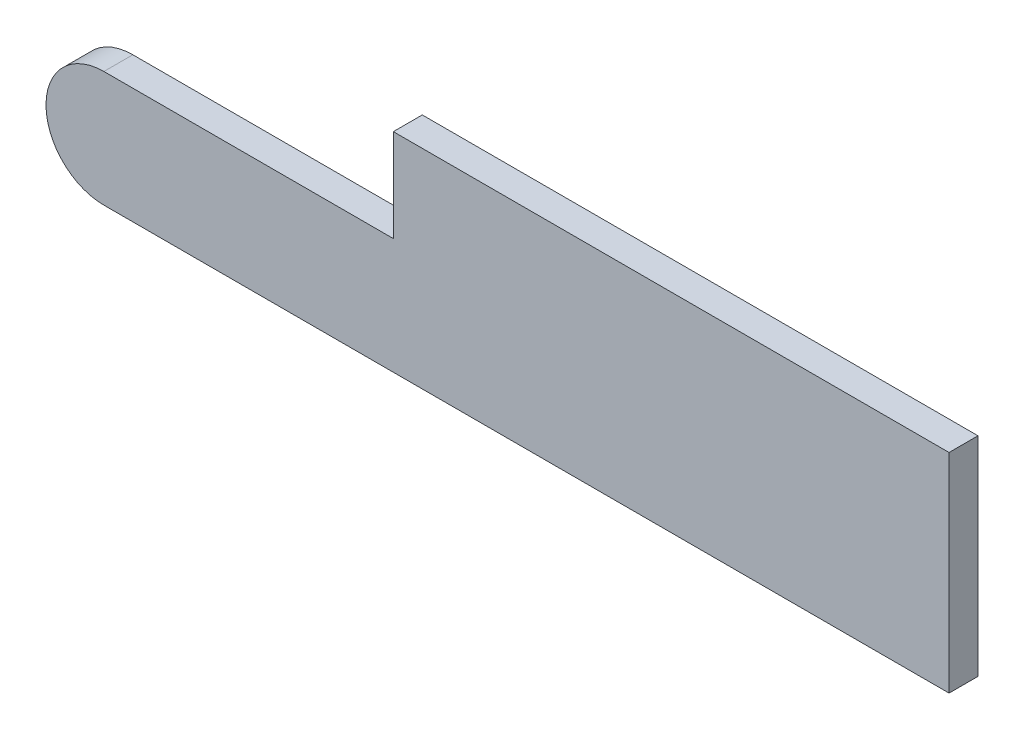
SolidWorks part; units mm, degrees
ref_plane "前视基准面" through (0, 0, 0) normal (0, 0, 1) x (1, 0, 0)
ref_plane "上视基准面" through (0, 0, 0) normal (0, 1, 0) x (1, 0, 0)
ref_plane "右视基准面" through (0, 0, 0) normal (1, 0, 0) x (0, 0, -1)
sketch "草图1" plane through (0, 0, 0) normal (0, 0, 1) x (1, 0, 0)
  line L0 (0, 0) -> (-3, 0)
  line L1 (-3, 0) -> (-3, 1)
  line L2 (-3, 1) -> (0, 1)
  line L3 (0, 1) -> (0, 1.8)
  line L4 (0, 1.8) -> (4.8, 1.8)
  line L5 (0, 0) -> (4.8, 0)
  line L6 (4.8, 0) -> (4.8, 1.8)
  dimension "D1" = 3
  dimension "D2" = 1
  dimension "D3" = 4.8
  dimension "D4" = 1.8
base flange "基体-法兰1" sketch "草图1" thickness 0.25 reverse thickness direction no parameters "D1"=10
fillet "圆角1" radius 0.5 2 edges at (-3, 0, -0.125) (-3, 1, -0.125)
sketch "折弯-线1" plane through (0, 0, 0) normal (0, 1, 0) x (1, 0, 0)
sketch "边界框1" plane through (0, 0, 0) normal (0, 1, 0) x (1, 0, 0)
sheet metal parameters "钣金6" thickness 0.25 parameters "D1"=10
flat pattern "平板型式6"
sketch "折弯-线2" plane through (0, 0, 0) normal (0, 1, 0) x (1, 0, 0)
sketch "边界框2" [suppressed] plane through (0, 0, 0) normal (0, 1, 0) x (1, 0, 0)
